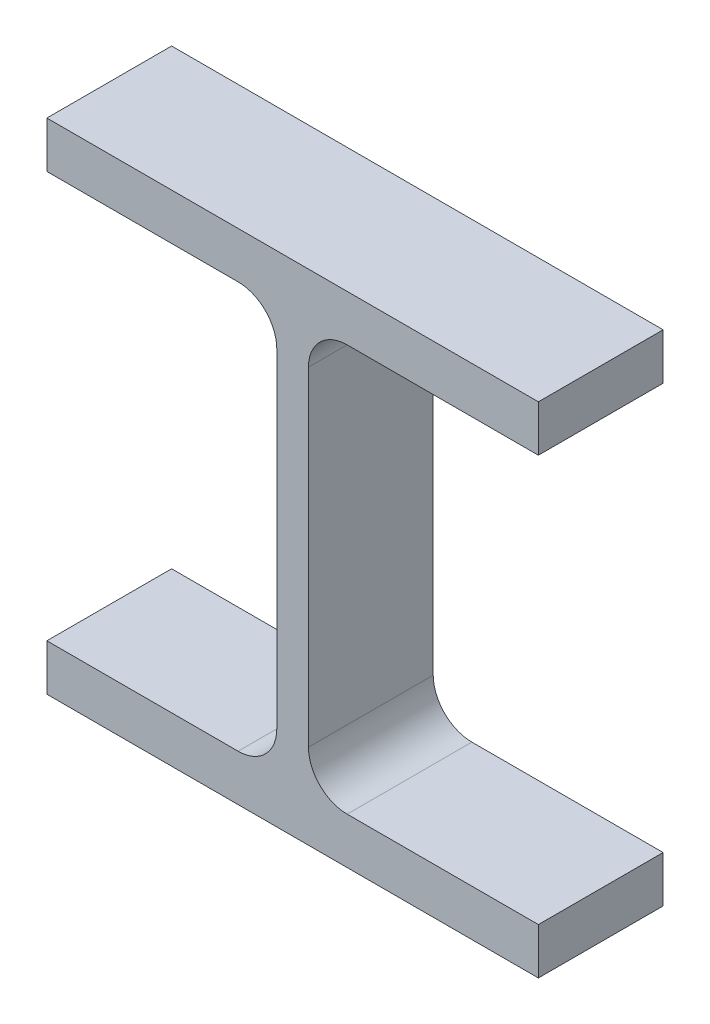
SolidWorks part; units mm, degrees
ref_plane "Plane1" through (0, 0, 0) normal (0, 0, 1) x (1, 0, 0)
ref_plane "Plane2" through (0, 0, 0) normal (0, 1, 0) x (1, 0, 0)
ref_plane "Plane3" through (0, 0, 0) normal (1, 0, 0) x (0, 0, -1)
sketch "Sketch1" plane through (0, 0, 0) normal (0, 0, 1) x (1, 0, 0)
  line L0 (0, 0) -> (0, 9.4234)
  line L1 (0, 9.4234) -> (38.9382, 9.4234)
  line L2 (46.8122, 17.2974) -> (46.8122, 84.3026)
  line L3 (38.9382, 92.1766) -> (0, 92.1766)
  line L4 (0, 92.1766) -> (0, 101.6)
  line L5 (0, 101.6) -> (100.076, 101.6)
  line L6 (100.076, 101.6) -> (100.076, 92.1766)
  line L7 (100.076, 92.1766) -> (61.1378, 92.1766)
  line L8 (53.2638, 84.3026) -> (53.2638, 17.2974)
  line L9 (61.1378, 9.4234) -> (100.076, 9.4234)
  line L10 (100.076, 9.4234) -> (100.076, 0)
  line L11 (100.076, 0) -> (0, 0)
  line L12 (50.038, -72.1361) -> (50.038, 101.6) construction
  arc A0 (38.9382, 9.4234) -> (46.8122, 17.2974) centre (38.9382, 17.2974) ccw
  arc A1 (46.8122, 84.3026) -> (38.9382, 92.1766) centre (38.9382, 84.3026) ccw
  arc A2 (61.1378, 92.1766) -> (53.2638, 84.3026) centre (61.1378, 84.3026) ccw
  arc A3 (53.2638, 17.2974) -> (61.1378, 9.4234) centre (61.1378, 17.2974) ccw
extrude "BaseSteelM" add sketch "Sketch1" against normal mid plane 25.4
equation "\"D1@Sketch1\" = \"Tw@Sketch1\" / 2"
equation "\"D2@Sketch1\" = \"Tf@Sketch1\""
